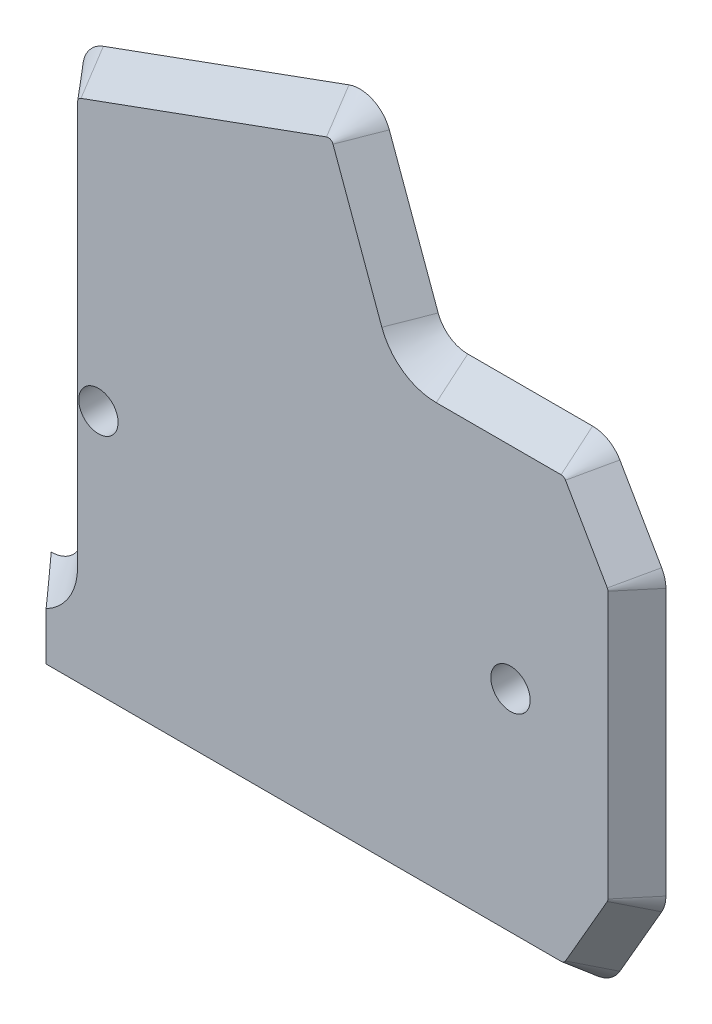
SolidWorks part; units mm, degrees
ref_plane "Front Plane" through (0, 0, 0) normal (0, 0, 1) x (1, 0, 0)
ref_plane "Top Plane" through (0, 0, 0) normal (0, 1, 0) x (1, 0, 0)
ref_plane "Right Plane" through (0, 0, 0) normal (1, 0, 0) x (0, 0, -1)
sketch "Sketch1" plane through (0, 0, 0) normal (0, 0, 1) x (1, 0, 0)
  line L9 (25.5, -6) -> (28.675, -6)
  line L10 (28.675, -6) -> (59.8894, -6)
  line L11 (61.6215, -5) -> (64.2762, -0.4019)
  line L12 (64.5441, 0.5981) -> (64.5441, 17.5263)
  line L13 (64.2762, 18.5263) -> (61.6215, 23.1244)
  line L14 (59.8894, 24.1244) -> (51.9586, 24.1244)
  line L15 (50.0792, 25.4403) -> (46.9779, 33.961)
  line L16 (27.5, 27.5996) -> (27.5, 2)
  line L17 (44.4145, 35.1564) -> (28.816, 29.479)
  line L18 (25.5, 0) -> (25.5, -6)
  arc A9 (25.5, 0) -> (27.5, 2) centre (25.5, 2) ccw
  arc A10 (59.8894, -6) -> (61.6215, -5) centre (59.8894, -4) ccw
  arc A11 (64.2762, -0.4019) -> (64.5441, 0.5981) centre (62.5441, 0.5981) ccw
  arc A12 (64.5441, 17.5263) -> (64.2762, 18.5263) centre (62.5441, 17.5263) ccw
  arc A13 (61.6215, 23.1244) -> (59.8894, 24.1244) centre (59.8894, 22.1244) ccw
  arc A14 (50.0792, 25.4403) -> (51.9586, 24.1244) centre (51.9586, 26.1244) ccw
  arc A15 (46.9779, 33.961) -> (44.4145, 35.1564) centre (45.0985, 33.277) ccw
  arc A16 (28.816, 29.479) -> (28.675, 29.4215) centre (29.5, 27.5996) ccw
  arc A17 (28.675, 29.4215) -> (27.5, 27.5996) centre (29.5, 27.5996) ccw
extrude "Boss-Extrude1" add sketch "Sketch1" along normal blind 2 draft 40
sketch "Sketch7" plane through (0, 0, 0) normal (0, 0, -1) x (-1, 0, 0)
  circle A2 centre (-56.675, 9.0622) radius 1.25
  circle A3 centre (-30.5, 11.2559) radius 1.25
  point P1 (-30, 11.2559)
  point P3 (-56.675, 9.0622)
hole_wizard "M3 Tapped Hole1" positions "Sketch8" profile "Sketch9" tap size "M3" standard "ISO"
sketch "Sketch8" plane through (0, 0, 2) normal (0, 0, 1) x (1, 0, 0)
  circle A0 centre (56.675, 9.0622) radius 1.25 construction
  circle A1 centre (30.5, 11.2559) radius 1.25 construction
  circle A2 centre (56.675, 9.0622) radius 1.25
  circle A3 centre (30.5, 11.2559) radius 1.25
  point P3 (56.675, 9.0622)
  point P5 (30.5, 11.2559)
sketch "Sketch9" plane through (56.675, 9.0622, 2) normal (1, 0, 0) x (0, -1, 0)
  line L0 (0, 0) -> (0, 2)
  line L1 (0, 2) -> (1.25, 2)
  line L2 (1.25, 2) -> (1.25, 0)
  line L5 (1.25, 0) -> (0, 0)
  line L11 (0, -6.35) -> (0, 107.95) construction
  dimension "Thru Tap Drill Dia." = 2.5
  dimension "Thru Tap Drill Depth" = 2
